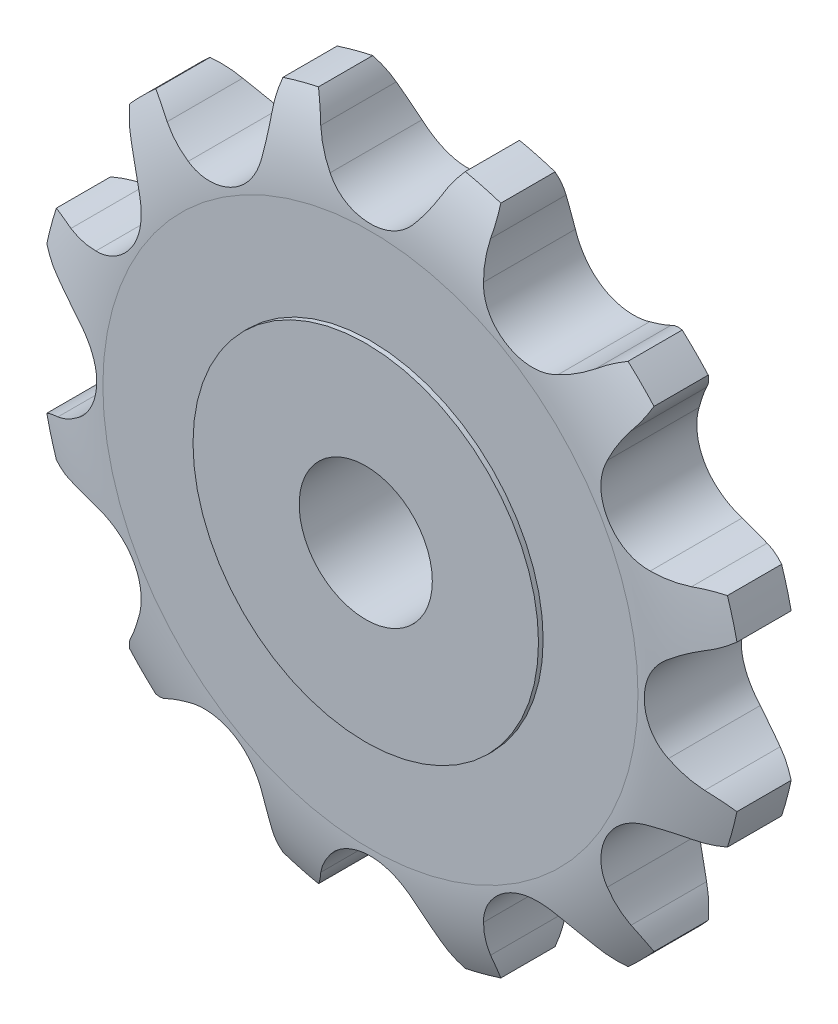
SolidWorks part; units mm, degrees
ref_plane "Front" through (0, 0, 0) normal (0, 0, 1) x (1, 0, 0)
ref_plane "Top" through (0, 0, 0) normal (0, 1, 0) x (1, 0, 0)
ref_plane "Right" through (0, 0, 0) normal (1, 0, 0) x (0, 0, -1)
sketch "ｽｹｯﾁ2" plane through (0, 0, 0) normal (0, 0, 1) x (1, 0, 0)
  line L0 (0, 48) -> (0, 0) construction
  line L3 (-3.65, 20.1) -> (-3.65, 12.977)
  line L4 (3.65, 12.977) -> (3.65, 20.1)
  line L5 (4, 12.977) -> (4, 5)
  line L6 (3.65, 12.977) -> (4, 12.977)
  line L7 (-3.65, 12.977) -> (-4, 12.977)
  line L11 (-4, 5) -> (-4, 12.977)
  line L12 (-9, 0) -> (9, 0) construction
  line L13 (4, 5) -> (-4, 5)
  line L15 (2.0365, 26.5) -> (-2.0365, 26.5)
  arc A85 (-2.0365, 26.5) -> (-3.65, 20.1) centre (9.85, 20.1) ccw
  arc A86 (3.65, 20.1) -> (2.0365, 26.5) centre (-9.85, 20.1) ccw
  point P5 (0, 26.5)
revolve "回転1" add sketch "ｽｹｯﾁ2" angle 360 about L12
move or copy body "ﾎﾞﾃﾞｨ-移動/ｺﾋﾟｰ1" bodies to move or copy 101 copy no rotation origin (0, 0, 0) rotation axis (0, 1, 0) rotation angle 90
sketch "ｽｹｯﾁ5" plane through (0, 0, 0) normal (0, 0, 1) x (1, 0, 0)
  arc A0 (-24.2928, -4.5432) -> (-22.18, -3.2252) centre (-28.6905, 4.8591) ccw
  arc A1 (22.18, -3.2252) -> (24.2928, -4.5432) centre (28.6905, 4.8591) ccw
  circle A2 centre (0, 0) radius 26.5 construction
  arc A3 (8.1853, -25.2042) -> (17.7348, -19.6907) centre (0, 0) ccw
  arc A4 (19.6907, -17.7348) -> (25.2042, -8.1853) centre (0, 0) ccw
  arc A5 (3.2252, -22.18) -> (-3.2252, -22.18) centre (0, -24.5929) ccw
  arc A6 (-8.2119, -23.3098) -> (-8.1853, -25.2042) centre (-1.5787, -24.1639) ccw
  arc A7 (-5.5135, -25.9201) -> (-4.5432, -24.2928) centre (-10.7148, -21.7159) ccw
  arc A8 (25.9201, -5.5135) -> (25.9201, 5.5135) centre (0, 0) ccw
  arc A9 (-13.8831, -17.5959) -> (-16.0809, -18.7666) centre (-10.1372, -27.2763) ccw
  arc A10 (-18.7666, -16.0809) -> (-17.5959, -13.8831) centre (-27.2763, -10.1372) ccw
  arc A11 (-17.7348, -19.6907) -> (-16.0809, -18.7666) centre (-20.1372, -13.4491) ccw
  arc A12 (25.2042, 8.1853) -> (19.6907, 17.7348) centre (0, 0) ccw
  arc A13 (-18.7666, -16.0809) -> (-19.6907, -17.7348) centre (-13.4491, -20.1372) ccw
  arc A14 (-20.8211, -8.2969) -> (-23.3098, -8.2119) centre (-22.4172, -18.5533) ccw
  arc A15 (17.7348, 19.6907) -> (8.1853, 25.2042) centre (0, 0) ccw
  arc A16 (-24.2928, -4.5432) -> (-25.9201, -5.5135) centre (-21.7159, -10.7148) ccw
  arc A17 (-25.2042, -8.1853) -> (-23.3098, -8.2119) centre (-24.1639, -1.5787) ccw
  arc A18 (-17.5959, -13.8831) -> (-20.8211, -8.2969) centre (-21.2981, -12.2964) ccw
  arc A19 (-8.2969, -20.8211) -> (-13.8831, -17.5959) centre (-12.2965, -21.2981) ccw
  arc A20 (-8.2119, -23.3098) -> (-8.2969, -20.8211) centre (-18.5533, -22.4172) ccw
  arc A21 (-3.2252, -22.18) -> (-4.5432, -24.2928) centre (4.8591, -28.6905) ccw
  arc A22 (4.5432, -24.2928) -> (5.5135, -25.9201) centre (10.7148, -21.7159) ccw
  arc A23 (8.1853, -25.2042) -> (8.2119, -23.3098) centre (1.5787, -24.1639) ccw
  arc A24 (5.5135, 25.9201) -> (-5.5135, 25.9201) centre (0, 0) ccw
  arc A25 (16.0809, -18.7666) -> (13.8831, -17.5959) centre (10.1372, -27.2763) ccw
  arc A26 (13.8831, -17.5959) -> (8.2969, -20.8211) centre (12.2964, -21.2981) ccw
  arc A27 (4.5432, -24.2928) -> (3.2252, -22.18) centre (-4.8591, -28.6905) ccw
  arc A28 (8.2969, -20.8211) -> (8.2119, -23.3098) centre (18.5533, -22.4172) ccw
  arc A29 (17.5959, -13.8831) -> (18.7666, -16.0809) centre (27.2763, -10.1372) ccw
  arc A30 (-8.1853, 25.2042) -> (-17.7348, 19.6907) centre (0, 0) ccw
  arc A31 (16.0809, -18.7666) -> (17.7348, -19.6907) centre (20.1372, -13.4491) ccw
  arc A32 (19.6907, -17.7348) -> (18.7666, -16.0809) centre (13.4491, -20.1372) ccw
  arc A33 (23.3098, -8.2119) -> (20.8211, -8.2969) centre (22.4172, -18.5533) ccw
  arc A34 (20.8211, -8.2969) -> (17.5959, -13.8831) centre (21.2981, -12.2965) ccw
  arc A35 (25.9201, -5.5135) -> (24.2928, -4.5432) centre (21.7159, -10.7148) ccw
  arc A36 (-19.6907, 17.7348) -> (-25.2042, 8.1853) centre (0, 0) ccw
  arc A37 (23.3098, -8.2119) -> (25.2042, -8.1853) centre (24.1639, -1.5787) ccw
  arc A38 (-3.2252, 22.18) -> (3.2252, 22.18) centre (0, 24.5929) ccw
  arc A39 (-16.0809, 18.7666) -> (-13.8831, 17.5959) centre (-10.1372, 27.2763) ccw
  arc A40 (-19.6907, 17.7348) -> (-18.7666, 16.0809) centre (-13.4491, 20.1372) ccw
  arc A41 (-13.8831, 17.5959) -> (-8.2969, 20.8211) centre (-12.2964, 21.2981) ccw
  arc A42 (-25.9201, 5.5135) -> (-25.9201, -5.5135) centre (0, 0) ccw
  arc A43 (-22.18, -3.2252) -> (-22.18, 3.2252) centre (-24.5929, 0) ccw
  arc A44 (-25.9201, 5.5135) -> (-24.2928, 4.5432) centre (-21.7159, 10.7148) ccw
  arc A45 (-22.18, 3.2252) -> (-24.2928, 4.5432) centre (-28.6905, -4.8591) ccw
  arc A46 (-23.3098, 8.2119) -> (-20.8211, 8.2969) centre (-22.4172, 18.5533) ccw
  arc A47 (-23.3098, 8.2119) -> (-25.2042, 8.1853) centre (-24.1639, 1.5787) ccw
  arc A48 (-20.8211, 8.2969) -> (-17.5959, 13.8831) centre (-21.2981, 12.2965) ccw
  arc A49 (-17.5959, 13.8831) -> (-18.7666, 16.0809) centre (-27.2763, 10.1372) ccw
  arc A50 (-25.2042, -8.1853) -> (-19.6907, -17.7348) centre (0, 0) ccw
  arc A51 (-16.0809, 18.7666) -> (-17.7348, 19.6907) centre (-20.1372, 13.4491) ccw
  arc A52 (-17.7348, -19.6907) -> (-8.1853, -25.2042) centre (0, 0) ccw
  arc A53 (-8.2969, 20.8211) -> (-8.2119, 23.3098) centre (-18.5533, 22.4172) ccw
  arc A54 (-8.1853, 25.2042) -> (-8.2119, 23.3098) centre (-1.5787, 24.1639) ccw
  arc A55 (-4.5432, 24.2928) -> (-3.2252, 22.18) centre (4.8591, 28.6905) ccw
  arc A56 (-4.5432, 24.2928) -> (-5.5135, 25.9201) centre (-10.7148, 21.7159) ccw
  arc A57 (18.7666, 16.0809) -> (19.6907, 17.7348) centre (13.4491, 20.1372) ccw
  arc A58 (13.8831, 17.5959) -> (16.0809, 18.7666) centre (10.1372, 27.2763) ccw
  arc A59 (8.2969, 20.8211) -> (13.8831, 17.5959) centre (12.2965, 21.2981) ccw
  arc A60 (-5.5135, -25.9201) -> (5.5135, -25.9201) centre (0, 0) ccw
  arc A61 (24.2928, 4.5432) -> (22.18, 3.2252) centre (28.6905, -4.8591) ccw
  arc A62 (22.18, 3.2252) -> (22.18, -3.2252) centre (24.5929, 0) ccw
  arc A63 (24.2928, 4.5432) -> (25.9201, 5.5135) centre (21.7159, 10.7148) ccw
  arc A64 (20.8211, 8.2969) -> (23.3098, 8.2119) centre (22.4172, 18.5533) ccw
  arc A65 (17.5959, 13.8831) -> (20.8211, 8.2969) centre (21.2981, 12.2964) ccw
  arc A66 (18.7666, 16.0809) -> (17.5959, 13.8831) centre (27.2763, 10.1372) ccw
  arc A67 (25.2042, 8.1853) -> (23.3098, 8.2119) centre (24.1639, 1.5787) ccw
  arc A69 (3.2252, 22.18) -> (4.5432, 24.2928) centre (-4.8591, 28.6905) ccw
  arc A70 (5.5135, 25.9201) -> (4.5432, 24.2928) centre (10.7148, 21.7159) ccw
  arc A71 (8.2119, 23.3098) -> (8.2969, 20.8211) centre (18.5533, 22.4172) ccw
  arc A72 (8.2119, 23.3098) -> (8.1853, 25.2042) centre (1.5787, 24.1639) ccw
  arc A74 (17.7348, 19.6907) -> (16.0809, 18.7666) centre (20.1372, 13.4491) ccw
extrude "ｶｯﾄ - 押し出し1" cut sketch "ｽｹｯﾁ5" against normal through all both and the other way through all
